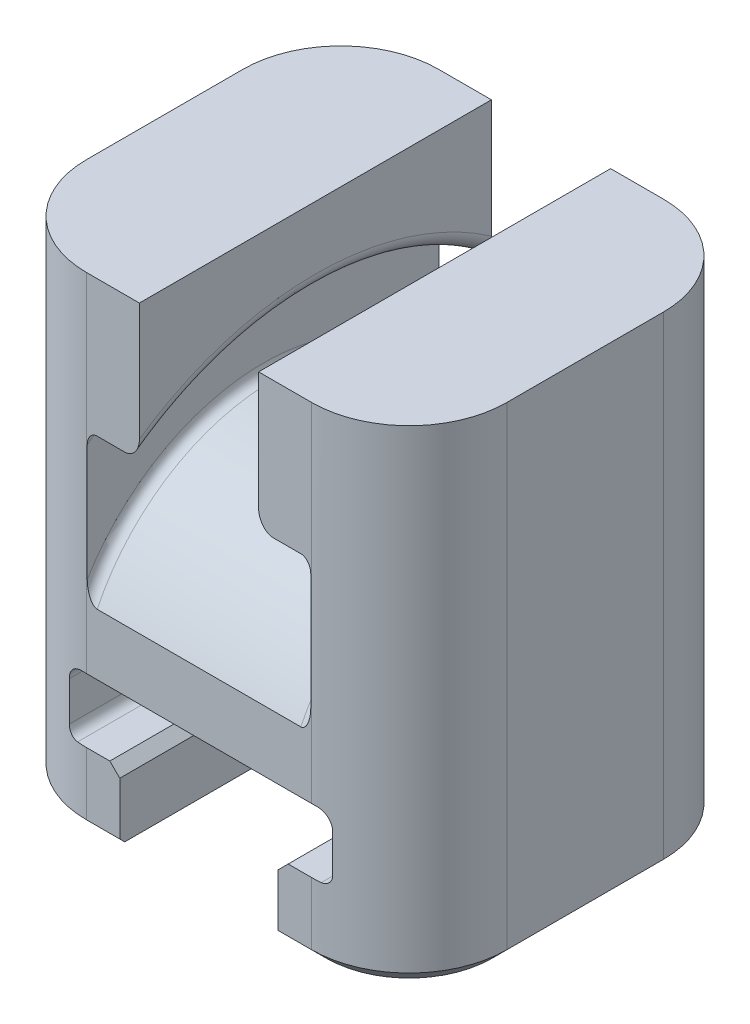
SolidWorks part; units mm, degrees
ref_plane "Front Plane" through (0, 0, 0) normal (0, 0, 1) x (1, 0, 0)
ref_plane "Top Plane" through (0, 0, 0) normal (0, 1, 0) x (1, 0, 0)
ref_plane "Right Plane" through (0, 0, 0) normal (1, 0, 0) x (0, 0, -1)
sketch "Sketch1" plane through (0, 0, 0) normal (1, 0, 0) x (0, 0, -1)
  line L0 (0, -6) -> (0, 0) construction
  line L1 (-9, 19) -> (9, 19)
  line L2 (-9, 19) -> (-9, -6)
  line L3 (-9, -6) -> (9, -6)
  line L4 (9, 19) -> (9, -6)
  dimension "D1" = 18
  dimension "D2" = 25
  dimension "D3" = 6
extrude "Extrude1" add sketch "Sketch1" along normal mid plane 21.5
sketch "Sketch2" plane through (0, 0, 0) normal (0, 0, -1) x (-1, 0, 0)
  line L0 (18.4383, 0) -> (-15.4771, 0) construction
  line L1 (5.715, 10) -> (5.715, 15.02)
  line L2 (5.715, 15.02) -> (3.048, 15.02)
  line L3 (-5.715, 15.02) -> (-5.715, 10)
  line L4 (-5.715, 10) -> (5.715, 10)
  line L5 (0, 0) -> (0, 10) construction
  line L6 (3.048, 15.02) -> (3.048, 26.45)
  line L7 (3.048, 26.45) -> (-3.048, 26.45)
  line L8 (-3.048, 26.45) -> (-3.048, 15.02)
  line L9 (-3.048, 15.02) -> (-5.715, 15.02)
  line L10 (0, 10) -> (0, 26.45) construction
  dimension "D1" = 10
  dimension "D2" = 15.02
  dimension "D4" = 11.43
  dimension "D6" = 6.096
  dimension "D7" = 11.43
revolve "Cut-Revolve1" cut sketch "Sketch2" angle 180 mid plane about L0
sketch "Sketch3" plane through (0, 0, 0) normal (0, 0, 1) x (1, 0, 0)
  line L0 (-6.731, 1.239) -> (6.731, 1.239)
  line L1 (6.731, 1.239) -> (6.731, -2.0376)
  line L2 (6.731, -2.0376) -> (4.0513, -2.0376)
  line L3 (4.0513, -2.0376) -> (4.0513, -6)
  line L4 (4.0513, -6) -> (-4.0513, -6)
  line L5 (-4.0513, -6) -> (-4.0513, -2.0376)
  line L6 (-4.0513, -2.0376) -> (-6.731, -2.0376)
  line L7 (-6.731, -2.0376) -> (-6.731, 1.239)
  line L8 (0, 4.948) -> (0, -9.8581) construction
  line L14 (10.75, -6) -> (-10.75, -6) construction
  dimension "D1" = 7.239
  dimension "D2" = 3.9624
  dimension "D3" = 13.462
  dimension "D4" = 8.1026
extrude "Cut-Extrude1" cut sketch "Sketch3" against normal through all both and the other way through all
fillet "Fillet1" radius 5 4 edges at (10.75, 6.5, -9) (10.75, 6.5, 9) (-10.75, 6.5, 9) (-10.75, 6.5, -9)
fillet "Fillet2" radius 0.5 2 edges at (6.731, -2.0376, 0) (-6.731, -2.0376, 0)
fillet "Fillet3" radius 0.508 4 edges at (5.715, 15.02, 0) (5.715, 10, 0) (-5.715, 10, 0) (-5.715, 15.02, 0)
fillet "Fillet4" radius 0.762 4 edges at (-3.048, 15.02, 0) (3.048, 15.02, 0) (-6.731, 1.239, 0) (6.731, 1.239, 0)
chamfer "Chamfer1" distance 0.508 angle 45 2 edges at (4.0513, -2.0376, 0) (-4.0513, -2.0376, 0)
chamfer "Chamfer2" distance 0.508 angle 45 2 edges at (-4.0513, -6, 0) (4.0513, -6, 0)
chamfer "Chamfer3" distance 0.762 angle 45 10 edges at (-9.2855, -6, 7.5355) (5.1547, -6, 9) (-5.1546, -6, 9) (-10.75, -6, 0) (5.1547, -6, -9) (-5.1546, -6, -9) (-9.2855, -6, -7.5355) (9.2855, -6, 7.5355) (10.75, -6, 0) (9.2855, -6, -7.5355)
